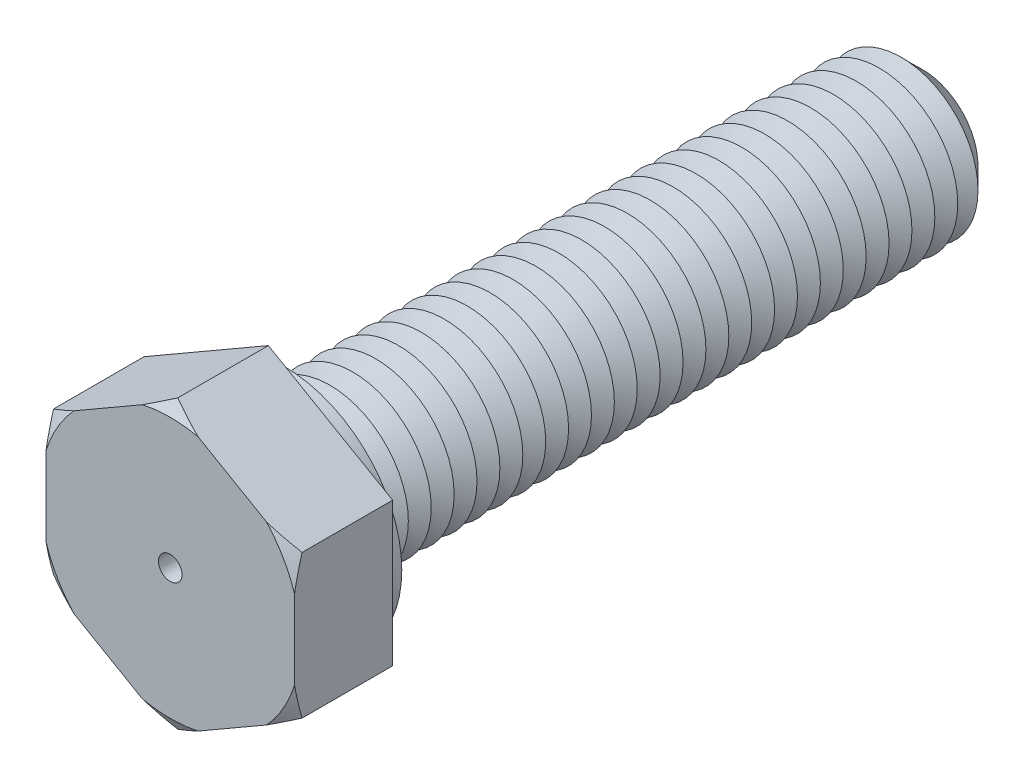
SolidWorks part; units mm, degrees
ref_plane "Front Plane" through (0, 0, 0) normal (0, 0, 1) x (1, 0, 0)
ref_plane "Top Plane" through (0, 0, 0) normal (0, 1, 0) x (1, 0, 0)
ref_plane "Right Plane" through (0, 0, 0) normal (1, 0, 0) x (0, 0, -1)
sketch "Sketch2" plane through (0, 0, 0) normal (0, 0, 1) x (1, 0, 0)
  line L1 (0, 10.9697) -> (-9.5, 5.4848)
  line L2 (-9.5, 5.4848) -> (-9.5, -5.4848)
  line L3 (-9.5, -5.4848) -> (0, -10.9697)
  line L4 (0, -10.9697) -> (9.5, -5.4848)
  line L5 (9.5, -5.4848) -> (9.5, 5.4848)
  line L6 (9.5, 5.4848) -> (0, 10.9697)
  circle A0 centre (0, 0) radius 9.5 construction
  dimension "D1" = 19
extrude "Boss-Extrude1" add sketch "Sketch2" along normal blind 7.5
sketch "Sketch3" plane through (0, 0, 0) normal (0, 0, -1) x (-1, 0, 0)
  circle A0 centre (0, 0) radius 6
  dimension "D1" = 12
extrude "Boss-Extrude2" add sketch "Sketch3" along normal blind 50
sketch "Sketch4" plane through (0, 0, 0) normal (0, 0, -1) x (-1, 0, 0)
  circle A0 centre (0, 0) radius 9
  dimension "D1" = 18
extrude "Boss-Extrude3" add sketch "Sketch4" along normal blind 1.2
sketch "Sketch5" plane through (0, 0, 0) normal (1, 0, 0) x (0, 0, -1)
  line L0 (-3.2117, 0) -> (6.3192, 0) construction
chamfer "Chamfer1" distance 1.75 angle 45 1 edges at (-6, 0, -50)
sketch "Sketch6" plane through (0, 0, 0) normal (1, 0, 0) x (0, 0, -1)
  line L0 (1.2, 6) -> (2.075, 4.4845)
  line L1 (2.075, 4.4845) -> (2.95, 6)
  line L2 (48.25, 6) -> (1.2, 6) construction
  line L3 (2.95, 6) -> (1.2, 6)
  dimension "D1" = 1.75
revolve "Cut-Revolve1" cut sketch "Sketch6" angle 360 about L0
pattern_linear "LPattern1" count 27 spacing 1.75 along (0, 0, -1) of "Cut-Revolve1"
sketch "Sketch7" plane through (0, 0, 0) normal (1, 0, 0) x (0, 0, -1)
  line L0 (-7.5, 10.9697) -> (-7.5, 9.9697)
  line L1 (-7.5, 5.4848) -> (-7.5, 10.9697) construction
  line L2 (-7.5, 9.9697) -> (-6.9226, 10.9697)
  line L3 (-7.5, 10.9697) -> (0, 10.9697) construction
  line L4 (-6.9226, 10.9697) -> (-7.5, 10.9697)
  dimension "D1" = 1
  dimension "D2" = 30
revolve "Cut-Revolve2" cut sketch "Sketch7" angle 360 about L0
sketch "Sketch8" plane through (0, 0, 7.5) normal (0, 0, 1) x (1, 0, 0)
  circle A0 centre (0, 0) radius 0.9
  dimension "D1" = 1.8
extrude "Cut-Extrude1" cut sketch "Sketch8" against normal up to surface (57.5 mm away)
